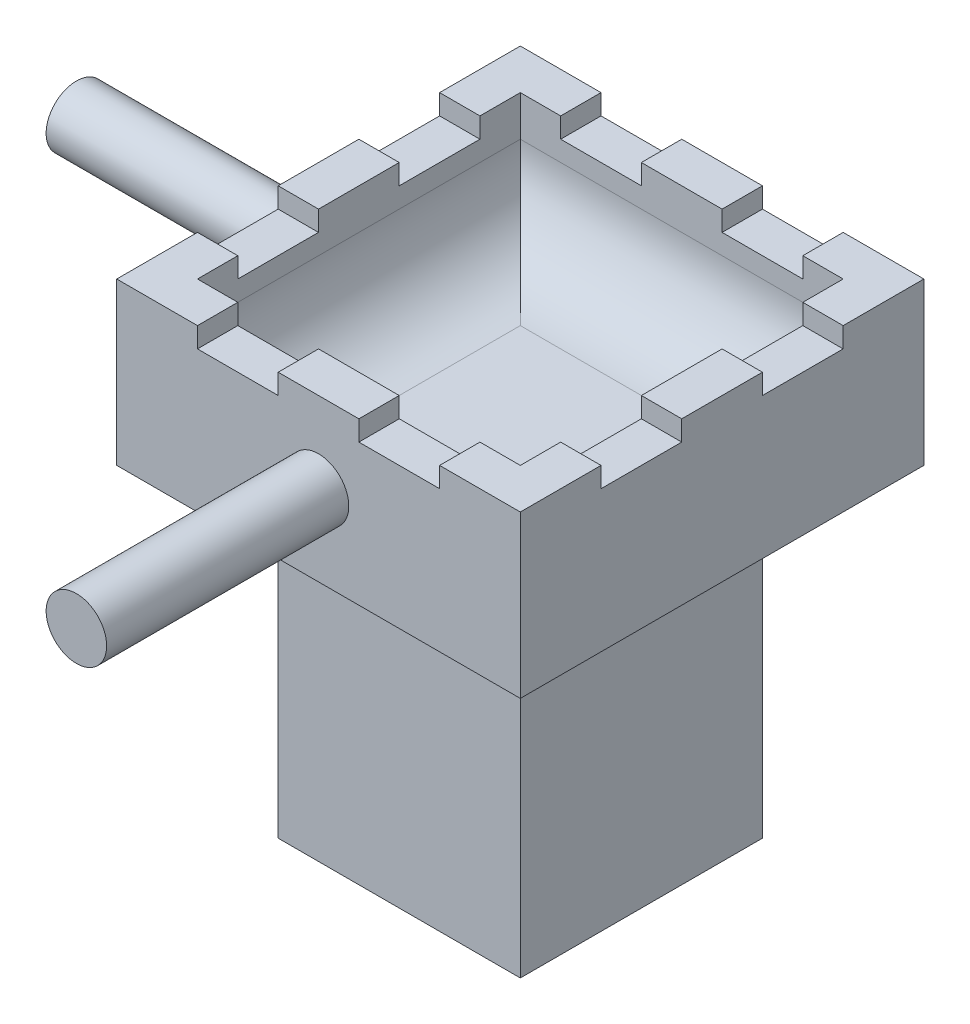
SolidWorks part; units mm, degrees
ref_plane "Front Plane" through (0, 0, 0) normal (0, 0, 1) x (1, 0, 0)
ref_plane "Top Plane" through (0, 0, 0) normal (0, 1, 0) x (1, 0, 0)
ref_plane "Right Plane" through (0, 0, 0) normal (1, 0, 0) x (0, 0, -1)
sketch "Sketch1" plane through (0, 0, 0) normal (0, 1, 0) x (1, 0, 0)
  line L1 (0, 0) -> (381, 0)
  line L2 (0, 0) -> (0, 381)
  line L3 (0, 381) -> (381, 381)
  line L4 (381, 0) -> (381, 381)
  dimension "D1" = 381
  dimension "D2" = 381
extrude "Boss-Extrude1" add sketch "Sketch1" along normal blind 152.4
sketch "Sketch2" plane through (0, 152.4, 0) normal (0, 1, 0) x (-1, 0, 0)
  line L0 (-190.5, -381) -> (-190.5, 0)
  line L1 (0, 0) -> (-76.2, 0)
  line L2 (0, 0) -> (0, -76.2)
  line L3 (0, -76.2) -> (-76.2, -76.2)
  line L4 (-76.2, 0) -> (-76.2, -76.2)
  line L5 (-381, -381) -> (0, -381) construction
  line L6 (0, 0) -> (-381, 0) construction
  line L7 (-381, -190.5) -> (0, -190.5)
  line L8 (-381, 0) -> (-381, -381) construction
  line L9 (0, -381) -> (0, 0) construction
  line L10 (-304.8, 0) -> (-304.8, -76.2)
  line L11 (-381, 0) -> (-304.8, 0)
  line L12 (-381, 0) -> (-381, -76.2)
  line L13 (-381, -76.2) -> (-304.8, -76.2)
  line L14 (-381, -381) -> (-304.8, -381)
  line L15 (-381, -381) -> (-381, -304.8)
  line L16 (-381, -304.8) -> (-304.8, -304.8)
  line L17 (-304.8, -381) -> (-304.8, -304.8)
  line L18 (0, -381) -> (0, -304.8)
  line L19 (0, -381) -> (-76.2, -381)
  line L20 (-76.2, -381) -> (-76.2, -304.8)
  line L21 (0, -304.8) -> (-76.2, -304.8)
  dimension "D1" = 76.2
  dimension "D2" = 76.2
extrude "Boss-Extrude2" add sketch "Sketch2" along normal blind 152.4 contours L21 L20 M1 M4 | L17 L16 M4 M3 | L13 L10 M3 M2 | L4 L3 M2 M1
ref_plane "Plane1" through (0, 0, -190.5) normal (0, 0, 1) x (1, 0, 0)
ref_plane "Plane2" through (190.5, 0, 0) normal (1, 0, 0) x (0, 0, -1)
sketch "Sketch4" plane through (0, 304.8, 0) normal (0, 1, 0) x (-1, 0, 0)
  line L1 (25.4, -279.4) -> (-101.6, -279.4)
  line L2 (25.4, -279.4) -> (25.4, -406.4)
  line L3 (25.4, -406.4) -> (-101.6, -406.4)
  line L4 (-101.6, -279.4) -> (-101.6, -406.4)
  line L5 (25.4, -279.4) -> (-101.6, -406.4) construction
  line L6 (25.4, -406.4) -> (-101.6, -279.4) construction
  line L10 (0, -304.8) -> (-76.2, -381) construction
  point P0 (-38.1, -342.9)
  dimension "D1" = 127
  dimension "D2" = 127
extrude "Cut-Extrude1" cut sketch "Sketch4" against normal blind 50.8
sketch "Sketch5" plane through (0, 254, 0) normal (0, 1, 0) x (-1, 0, 0)
  line L0 (0, -304.8) -> (-76.2, -381) construction
  line L1 (-304.8, -381) -> (-76.2, -381) construction
  line L2 (-76.2, -381) -> (-76.2, -304.8) construction
  line L4 (25.4, -279.4) -> (-101.6, -279.4)
  line L5 (25.4, -279.4) -> (25.4, -406.4)
  line L6 (25.4, -406.4) -> (-101.6, -406.4)
  line L7 (-101.6, -279.4) -> (-101.6, -406.4)
  line L8 (25.4, -279.4) -> (-101.6, -406.4) construction
  line L9 (25.4, -406.4) -> (-101.6, -279.4) construction
  point P7 (-38.1, -342.9)
  dimension "D1" = 127
  dimension "D2" = 127
extrude "Boss-Extrude3" add sketch "Sketch5" along normal up to surface (50.8 mm away)
shell "Shell1" thickness 12.7
sketch "Sketch8" plane through (-25.4, 0, 0) normal (-1, 0, 0) x (0, 0, 1)
  line L0 (-279.4, 304.8) -> (-279.4, 254) construction
  line L1 (-406.4, 304.8) -> (-279.4, 304.8)
  line L2 (-406.4, 304.8) -> (-406.4, 298.45)
  line L3 (-406.4, 298.45) -> (-279.4, 298.45)
  line L4 (-279.4, 304.8) -> (-279.4, 298.45)
  line L5 (-381, 304.8) -> (-381, 298.45)
  line L6 (-355.6, 304.8) -> (-355.6, 298.45)
  line L7 (-330.2, 304.8) -> (-330.2, 298.45)
  line L8 (-304.8, 304.8) -> (-304.8, 298.45)
  dimension "D1" = 6.35
  dimension "D2" = 5
ref_plane "Plane3" through (0, 0, -342.9) normal (0, 0, -1) x (-1, 0, 0)
ref_plane "Plane4" through (38.1, 0, 0) normal (-1, 0, 0) x (0, 0, 1)
extrude "Cut-Extrude2" cut sketch "Sketch8" against normal blind 50.8 contours L6 L1 L5 L3 | L8 L1 L7 L3
mirror "Mirror1" about plane through (38.1, 0, 0) normal (-1, 0, 0) of "Cut-Extrude2"
sketch "Sketch9" plane through (0, 0, -406.4) normal (0, 0, -1) x (-1, 0, 0)
  line L0 (25.4, 304.8) -> (25.4, 254) construction
  line L1 (-101.6, 304.8) -> (25.4, 304.8)
  line L2 (-101.6, 304.8) -> (-101.6, 298.45)
  line L3 (-101.6, 298.45) -> (25.4, 298.45)
  line L4 (28.3679, 304.8) -> (28.3679, 311.4741)
  line L5 (25.4, 304.8) -> (25.4, 298.45)
  line L6 (-76.2, 304.8) -> (-76.2, 298.45)
  line L7 (-50.8, 304.8) -> (-50.8, 298.45)
  line L8 (-25.4, 304.8) -> (-25.4, 298.45)
  line L9 (0, 304.8) -> (0, 298.45)
  dimension "D1" = 6.35
  dimension "D2" = 5
extrude "Cut-Extrude3" cut sketch "Sketch9" against normal blind 50.8 contours L7 L1 L6 L3 | L9 L1 L8 L3
mirror "Mirror2" about plane through (0, 0, -342.9) normal (0, 0, -1) of "Cut-Extrude3"
mirror "Mirror4" about plane through (190.5, 0, 0) normal (1, 0, 0) of "Boss-Extrude3", "Cut-Extrude1"
sketch "Sketch10" plane through (0, 304.8, 0) normal (0, 1, 0) x (-1, 0, 0)
  line L0 (-279.4, -279.4) -> (-406.4, -406.4) construction
  line L2 (-292.1, -292.1) -> (-393.7, -292.1)
  line L3 (-292.1, -292.1) -> (-292.1, -393.7)
  line L4 (-292.1, -393.7) -> (-393.7, -393.7)
  line L5 (-393.7, -292.1) -> (-393.7, -393.7)
  line L6 (-292.1, -292.1) -> (-393.7, -393.7) construction
  line L7 (-292.1, -393.7) -> (-393.7, -292.1) construction
  point P4 (-342.9, -342.9)
  dimension "D1" = 101.6
  dimension "D2" = 101.6
extrude "Cut-Extrude4" cut sketch "Sketch10" against normal up to surface (38.1 mm away)
mirror "Mirror5" about plane through (190.5, 0, 0) normal (1, 0, 0) of "Mirror2", "Cut-Extrude3", "Mirror1", "Cut-Extrude2"
mirror "Mirror6" about plane through (0, 0, -190.5) normal (0, 0, 1) of "Cut-Extrude4"
sketch "Sketch11" plane through (0, 266.7, 0) normal (0, 1, 0) x (-1, 0, 0)
  line L0 (-304.8, 0) -> (-381, -76.2) construction
  line L2 (-279.4, 25.4) -> (-406.4, 25.4)
  line L3 (-279.4, 25.4) -> (-279.4, -101.6)
  line L4 (-279.4, -101.6) -> (-406.4, -101.6)
  line L5 (-406.4, 25.4) -> (-406.4, -101.6)
  line L6 (-279.4, 25.4) -> (-406.4, -101.6) construction
  line L7 (-279.4, -101.6) -> (-406.4, 25.4) construction
  point P4 (-342.9, -38.1)
  dimension "D1" = 127
  dimension "D2" = 127
extrude "Boss-Extrude5" add sketch "Sketch11" along normal up to surface (38.1 mm away)
sketch "Sketch14" plane through (0, 304.8, 0) normal (0, 1, 0) x (-1, 0, 0)
  line L1 (28.5645, 41.7601) -> (-108.2544, 41.7601)
  line L2 (28.5645, 41.7601) -> (28.5645, -100.3894)
  line L3 (28.5645, -100.3894) -> (-108.2544, -100.3894)
  line L4 (-108.2544, 41.7601) -> (-108.2544, -100.3894)
  line L5 (28.5645, 41.7601) -> (-108.2544, -100.3894) construction
  line L6 (28.5645, -100.3894) -> (-108.2544, 41.7601) construction
  point P0 (-39.8449, -29.3147)
extrude "Cut-Extrude8" cut sketch "Sketch14" against normal blind 50.8
sketch "Sketch15" plane through (0, 12.7, 0) normal (0, 1, 0) x (-1, 0, 0)
  line L1 (-12.7, -12.7) -> (-63.5, -12.7)
  line L2 (-12.7, -12.7) -> (-12.7, -63.5)
  line L3 (-12.7, -63.5) -> (-63.5, -63.5)
  line L4 (-63.5, -12.7) -> (-63.5, -63.5)
extrude "Boss-Extrude6" add sketch "Sketch15" along normal up to surface (241.3 mm away)
sketch "Sketch16" plane through (0, 254, 0) normal (0, 1, 0) x (-1, 0, 0)
  line L0 (0, 0) -> (-76.2, -76.2) construction
  line L2 (-101.6, 25.4) -> (25.4, 25.4)
  line L3 (-101.6, 25.4) -> (-101.6, -101.6)
  line L4 (-101.6, -101.6) -> (25.4, -101.6)
  line L5 (25.4, 25.4) -> (25.4, -101.6)
  line L6 (-101.6, 25.4) -> (25.4, -101.6) construction
  line L7 (-101.6, -101.6) -> (25.4, 25.4) construction
  point P4 (-38.1, -38.1)
  dimension "D1" = 127
  dimension "D2" = 127
extrude "Boss-Extrude7" add sketch "Sketch16" along normal up to surface (50.8 mm away)
sketch "Sketch17" plane through (0, 304.8, 0) normal (0, 1, 0) x (-1, 0, 0)
  line L0 (25.4, 25.4) -> (-101.6, -101.6) construction
  line L2 (12.7, 12.7) -> (-88.9, 12.7)
  line L3 (12.7, 12.7) -> (12.7, -88.9)
  line L4 (12.7, -88.9) -> (-88.9, -88.9)
  line L5 (-88.9, 12.7) -> (-88.9, -88.9)
  line L6 (12.7, 12.7) -> (-88.9, -88.9) construction
  line L7 (12.7, -88.9) -> (-88.9, 12.7) construction
  point P4 (-38.1, -38.1)
  dimension "D1" = 101.6
extrude "Cut-Extrude9" cut sketch "Sketch17" against normal up to surface (38.1 mm away)
mirror "Mirror9" about plane through (0, 0, -190.5) normal (0, 0, 1) of "Mirror1", "Mirror2", "Cut-Extrude2", "Cut-Extrude3"
sketch "Sketch18" plane through (0, 304.8, 0) normal (0, 1, 0) x (-1, 0, 0)
  line L1 (-231.7467, 65.7478) -> (-453.8553, 65.7478)
  line L2 (-231.7467, 65.7478) -> (-231.7467, -135.0383)
  line L3 (-231.7467, -135.0383) -> (-453.8553, -135.0383)
  line L4 (-453.8553, 65.7478) -> (-453.8553, -135.0383)
  line L5 (-231.7467, 65.7478) -> (-453.8553, -135.0383) construction
  line L6 (-231.7467, -135.0383) -> (-453.8553, 65.7478) construction
  point P0 (-342.801, -34.6453)
extrude "Cut-Extrude10" cut sketch "Sketch18" against normal blind 50.8
sketch "Sketch19" plane through (0, 12.7, 0) normal (0, 1, 0) x (-1, 0, 0)
  line L1 (-317.5, -12.7) -> (-368.3, -12.7)
  line L2 (-317.5, -12.7) -> (-317.5, -63.5)
  line L3 (-317.5, -63.5) -> (-368.3, -63.5)
  line L4 (-368.3, -12.7) -> (-368.3, -63.5)
extrude "Boss-Extrude8" add sketch "Sketch19" along normal up to surface (241.3 mm away)
sketch "Sketch20" plane through (0, 254, 0) normal (0, 1, 0) x (-1, 0, 0)
  line L0 (-304.8, 0) -> (-381, -76.2) construction
  line L2 (-279.4, 25.4) -> (-406.4, 25.4)
  line L3 (-279.4, 25.4) -> (-279.4, -101.6)
  line L4 (-279.4, -101.6) -> (-406.4, -101.6)
  line L5 (-406.4, 25.4) -> (-406.4, -101.6)
  line L6 (-279.4, 25.4) -> (-406.4, -101.6) construction
  line L7 (-279.4, -101.6) -> (-406.4, 25.4) construction
  point P4 (-342.9, -38.1)
  dimension "D1" = 127
  dimension "D2" = 127
extrude "Boss-Extrude9" add sketch "Sketch20" along normal up to surface (50.8 mm away)
sketch "Sketch21" plane through (0, 304.8, 0) normal (0, 1, 0) x (-1, 0, 0)
  line L0 (-279.4, 25.4) -> (-406.4, -101.6) construction
  line L2 (-292.1, 12.7) -> (-393.7, 12.7)
  line L3 (-292.1, 12.7) -> (-292.1, -88.9)
  line L4 (-292.1, -88.9) -> (-393.7, -88.9)
  line L5 (-393.7, 12.7) -> (-393.7, -88.9)
  line L6 (-292.1, 12.7) -> (-393.7, -88.9) construction
  line L7 (-292.1, -88.9) -> (-393.7, 12.7) construction
  point P4 (-342.9, -38.1)
  dimension "D1" = 101.6
  dimension "D2" = 101.6
extrude "Cut-Extrude11" cut sketch "Sketch21" against normal up to surface (38.1 mm away)
sketch "Sketch23" plane through (0, 0, 25.4) normal (0, 0, 1) x (1, 0, 0)
  line L0 (406.4, 304.8) -> (406.4, 254) construction
  line L1 (279.4, 304.8) -> (406.4, 304.8)
  line L2 (279.4, 304.8) -> (279.4, 298.45)
  line L3 (279.4, 298.45) -> (406.4, 298.45)
  line L4 (406.4, 304.8) -> (406.4, 298.45)
  line L5 (304.8, 304.8) -> (304.8, 298.45)
  line L6 (330.2, 304.8) -> (330.2, 298.45)
  line L7 (355.6, 304.8) -> (355.6, 298.45)
  line L8 (381, 304.8) -> (381, 298.45)
  dimension "D1" = 6.35
  dimension "D2" = 5
extrude "Cut-Extrude12" cut sketch "Sketch23" against normal blind 152.4 contours L6 L1 L5 L3 | L8 L1 L7 L3
sketch "Sketch24" plane through (406.4, 0, 0) normal (1, 0, 0) x (0, 0, -1)
  line L0 (101.6, 304.8) -> (101.6, 254) construction
  line L1 (-25.4, 304.8) -> (101.6, 304.8)
  line L2 (-25.4, 304.8) -> (-25.4, 298.45)
  line L3 (-25.4, 298.45) -> (101.6, 298.45)
  line L4 (101.6, 304.8) -> (101.6, 298.45)
  line L5 (0, 304.8) -> (0, 298.45)
  line L6 (25.4, 304.8) -> (25.4, 298.45)
  line L7 (50.8, 304.8) -> (50.8, 298.45)
  line L8 (76.2, 304.8) -> (76.2, 298.45)
  dimension "D1" = 6.35
  dimension "D2" = 5
extrude "Cut-Extrude13" cut sketch "Sketch24" against normal blind 152.4 contours L6 L1 L5 L3 | L8 L1 L7 L3
sketch "Sketch25" plane through (0, 0, 0) normal (0, 0, 1) x (1, 0, 0)
  line L0 (190.5, 152.4) -> (190.5, 0) construction
  line L1 (76.2, 152.4) -> (304.8, 152.4) construction
  line L2 (0, 0) -> (381, 0) construction
  line L6 (152.4, 19.05) -> (228.6, 19.05)
  line L7 (152.4, 19.05) -> (152.4, 95.25)
  line L8 (152.4, 95.25) -> (228.6, 95.25)
  line L9 (228.6, 19.05) -> (228.6, 95.25)
  line L10 (152.4, 19.05) -> (228.6, 95.25) construction
  line L11 (152.4, 95.25) -> (228.6, 19.05) construction
  arc A0 (152.4, 95.25) -> (228.6, 95.25) centre (190.5, 95.25) cw
  point P6 (190.5, 57.15)
  point P12 (190.5, 76.2)
  dimension "D1" = 19.05
  dimension "D2" = 76.2
extrude "Cut-Extrude14" cut sketch "Sketch25" against normal blind 152.4 contours L6 L9 L8 L7 | A0 L8
sketch "Sketch27" plane through (0, 12.7, 0) normal (0, 1, 0) x (1, 0, 0)
  line L1 (12.7, 368.3) -> (63.5, 368.3)
  line L2 (12.7, 368.3) -> (12.7, 317.5)
  line L3 (12.7, 317.5) -> (63.5, 317.5)
  line L4 (63.5, 368.3) -> (63.5, 317.5)
extrude "Boss-Extrude10" add sketch "Sketch27" along normal up to surface (254 mm away)
fillet "Fillet1" radius 25.4 16 edges at (342.9, 266.7, 12.7) (292.1, 266.7, -38.1) (342.9, 266.7, -88.9) (393.7, 266.7, -38.1) (342.9, 266.7, -292.1) (292.1, 266.7, -342.9) (342.9, 266.7, -393.7) (393.7, 266.7, -342.9) (38.1, 266.7, 12.7) (-12.7, 266.7, -38.1) (38.1, 266.7, -88.9) (88.9, 266.7, -38.1) (38.1, 266.7, -292.1) (-12.7, 266.7, -342.9) (38.1, 266.7, -393.7) (88.9, 266.7, -342.9)
sketch "Sketch31" plane through (0, 0, 25.4) normal (0, 0, 1) x (1, 0, 0)
  line L0 (38.1, 304.8) -> (38.1, 254) construction
  line L1 (25.4, 304.8) -> (50.8, 304.8) construction
  line L2 (76.2, 254) -> (0, 254) construction
  line L3 (342.9, 304.8) -> (342.9, 254) construction
  line L4 (330.2, 304.8) -> (355.6, 304.8) construction
  line L5 (381, 254) -> (304.8, 254) construction
  circle A0 centre (38.1, 279.4) radius 9.525
  circle A1 centre (342.9, 279.4) radius 9.525
  dimension "D1" = 19.05
  dimension "D2" = 19.05
extrude "Boss-Extrude15" add sketch "Sketch31" along normal blind 76.2
sketch "Sketch32" plane through (-25.4, 0, 0) normal (-1, 0, 0) x (0, 0, 1)
  line L0 (-38.1, 304.8) -> (-38.1, 254) construction
  line L1 (-50.8, 304.8) -> (-25.4, 304.8) construction
  line L2 (-101.6, 254) -> (25.4, 254) construction
  circle A0 centre (-38.1, 279.4) radius 9.525
  dimension "D1" = 19.05
extrude "Boss-Extrude16" add sketch "Sketch32" along normal blind 76.2
sketch "Sketch34" plane through (406.4, 0, 0) normal (1, 0, 0) x (0, 0, -1)
  line L0 (38.1, 304.8) -> (38.1, 254) construction
  line L1 (25.4, 304.8) -> (50.8, 304.8) construction
  line L2 (-25.4, 254) -> (101.6, 254) construction
  circle A0 centre (38.1, 279.4) radius 9.525
  dimension "D1" = 19.05
extrude "Boss-Extrude17" add sketch "Sketch34" along normal blind 76.2
mirror "Mirror10" about plane through (0, 0, -190.5) normal (0, 0, 1) of "Boss-Extrude17", "Boss-Extrude15", "Boss-Extrude16"
sketch "Sketch35" plane through (0, 0, 0) normal (0, 0, 1) x (1, 0, 0)
  line L0 (-125.3752, 152.4) -> (497.1927, 152.4)
extrude "Cut-Extrude16" cut sketch "Sketch35" against normal through all and the other way through all flip side to cut
sketch "Sketch22" plane through (0, 0, 0) normal (0, 0, 1) x (1, 0, 0)
  line L1 (161.9239, 34.0446) -> (218.2183, 34.0446)
  line L2 (161.9239, 34.0446) -> (161.9239, 109.5615)
  line L3 (161.9239, 109.5615) -> (218.2183, 109.5615)
  line L4 (218.2183, 34.0446) -> (218.2183, 109.5615)
  line L5 (161.9239, 34.0446) -> (218.2183, 109.5615) construction
  line L6 (161.9239, 109.5615) -> (218.2183, 34.0446) construction
  arc A0 (161.9239, 109.5615) -> (218.2183, 109.5615) centre (190.0711, 109.5615) cw
  point P0 (190.0711, 71.8031)
